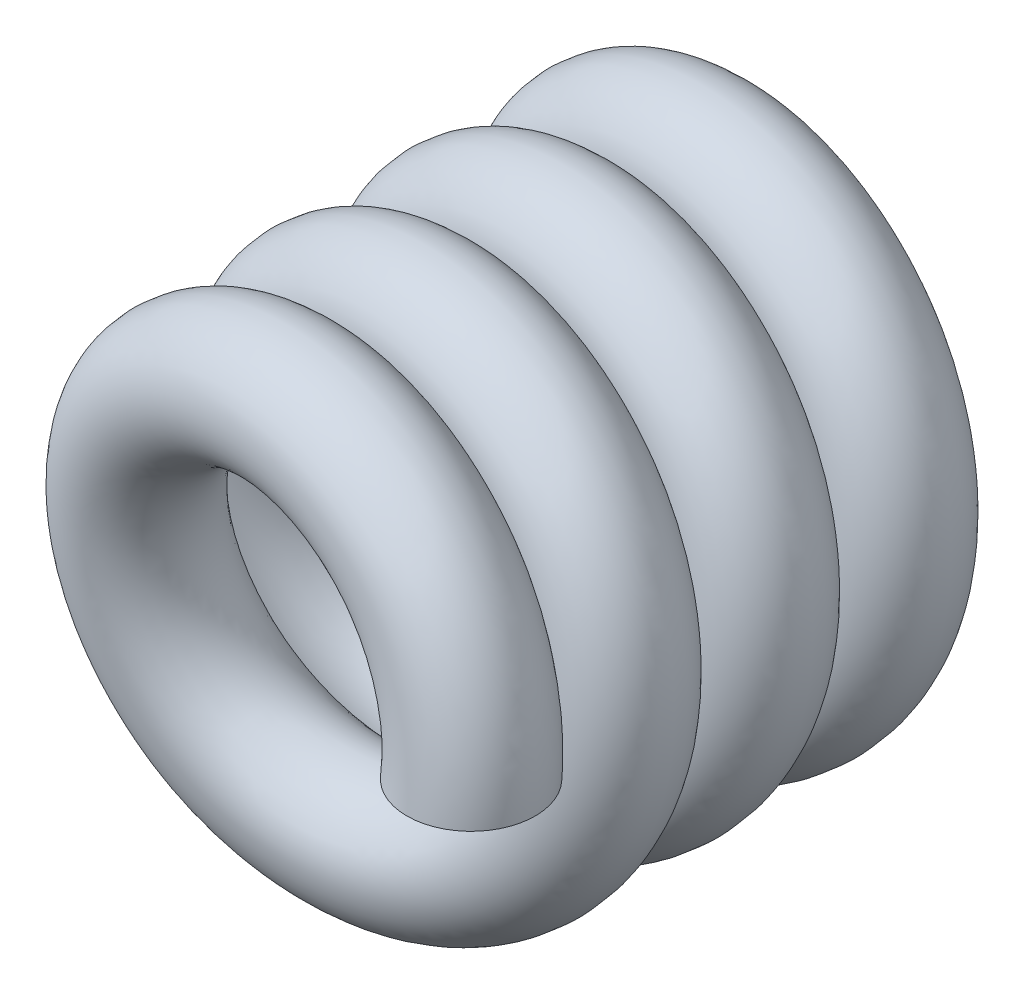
SolidWorks part; units mm, degrees
ref_plane "Front" through (0, 0, 0) normal (0, 0, 1) x (1, 0, 0)
ref_plane "Top" through (0, 0, 0) normal (0, 1, 0) x (1, 0, 0)
ref_plane "Side" through (0, 0, 0) normal (1, 0, 0) x (0, 0, -1)
sketch "Sketch2" plane through (0, 0, 0) normal (0, 0, 1) x (1, 0, 0)
  circle A0 centre (0, 0) radius 3.175
curve "Helix/Spiral1"
sketch "Sketch4" plane through (0, 0, 0) normal (0, 1, 0) x (1, 0, 0)
  circle A0 centre (-2.032, 0) radius 0.6477
sweep "Sweep1" add profiles "Sketch4" path "Helix/Spiral1"
